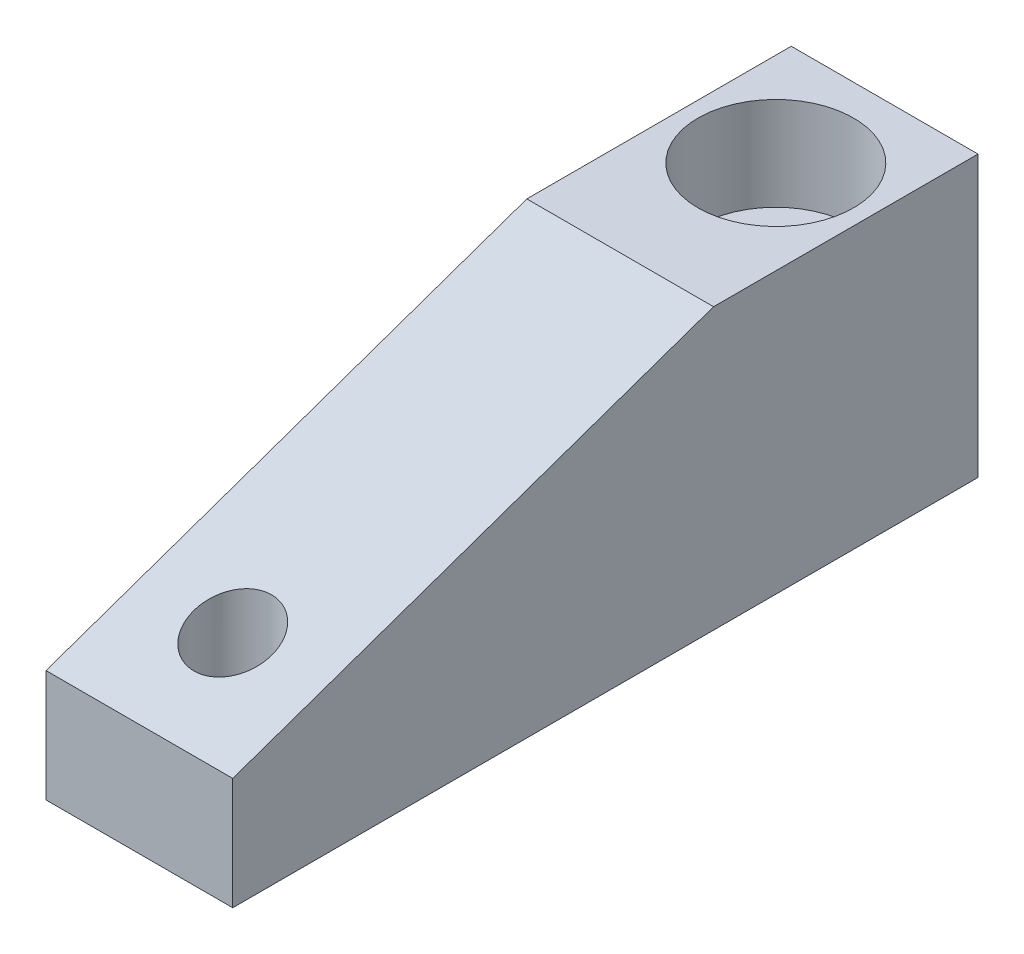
SolidWorks part; units mm, degrees
ref_plane "Front Plane" through (0, 0, 0) normal (0, 0, 1) x (1, 0, 0)
ref_plane "Top Plane" through (0, 0, 0) normal (0, 1, 0) x (1, 0, 0)
ref_plane "Right Plane" through (0, 0, 0) normal (1, 0, 0) x (0, 0, -1)
sketch "Sketch1" plane through (0, 0, 0) normal (0, 1, 0) x (1, 0, 0)
  line L1 (0, 0) -> (19.05, 0)
  line L2 (0, 0) -> (0, -76.0222)
  line L3 (0, -76.0222) -> (19.05, -76.0222)
  line L4 (19.05, 0) -> (19.05, -76.0222)
  dimension "D1" = 19.05
  dimension "D2" = 76.0222
extrude "Extrude1" add sketch "Sketch1" along normal blind 28.575
ref_plane "Plane1" through (9.525, 0, 0) normal (1, 0, 0) x (0, 0, -1)
sketch "Sketch3" plane through (9.525, 0, 0) normal (1, 0, 0) x (0, 0, -1)
  line L0 (-11.0998, 31.6794) -> (-11.0998, -3.5955) construction
  line L1 (0, 28.575) -> (0, 0) construction
  line L2 (-19.0373, 28.575) -> (-19.0373, 19.05)
  line L3 (-76.0222, 28.575) -> (0, 28.575) construction
  line L4 (-19.0373, 19.05) -> (-16.0528, 19.05)
  line L5 (-16.0528, 19.05) -> (-16.0528, 13.1064)
  line L6 (-16.0528, 13.1064) -> (-18.6, 13.1064)
  line L7 (-18.6, 13.1064) -> (-19.0119, 0)
  line L8 (-76.0222, 0) -> (0, 0) construction
  line L9 (-19.0119, 0) -> (-11.0998, 0)
  line L10 (-11.0998, 0) -> (-11.0998, 28.575)
  line L11 (-11.0998, 28.575) -> (-19.0373, 28.575)
  dimension "D1" = 11.0998
  dimension "D2" = 15.875
  dimension "D3" = 9.525
  dimension "D4" = 9.906
  dimension "D5" = 13.1064
  dimension "D6" = 1.8
  dimension "D7" = 15.8242
revolve "Cut-Revolve1" cut sketch "Sketch3" angle 360 about L0
fillet "Fillet1" radius 0.381 1 edges at (9.525, 13.1064, 18.6)
sketch "Sketch4" plane through (19.05, 0, 0) normal (1, 0, 0) x (0, 0, -1)
  line L0 (-76.0222, 11.43) -> (-76.0222, 28.575)
  line L1 (-76.0222, 28.575) -> (0, 28.575) construction
  line L2 (-76.0222, 28.575) -> (-26.9748, 28.575)
  line L3 (-76.0222, 11.43) -> (-26.9748, 28.575)
  line L4 (-76.0222, 28.575) -> (-76.0222, 0) construction
  line L6 (-11.0998, 19.05) -> (-11.0998, 28.575) construction
  line L7 (-76.0222, 0) -> (0, 0) construction
  dimension "D1" = 15.875
  dimension "D2" = 11.43
extrude "Cut-Extrude1" cut sketch "Sketch4" against normal through all
sketch "Sketch5" plane through (0, 0, 0) normal (0, -1, 0) x (1, 0, 0)
  circle A0 centre (9.525, 66.4972) radius 3.9624
  dimension "D1" = 7.9248
  dimension "D2" = 55.3974
extrude "Cut-Extrude2" cut sketch "Sketch5" against normal through all
